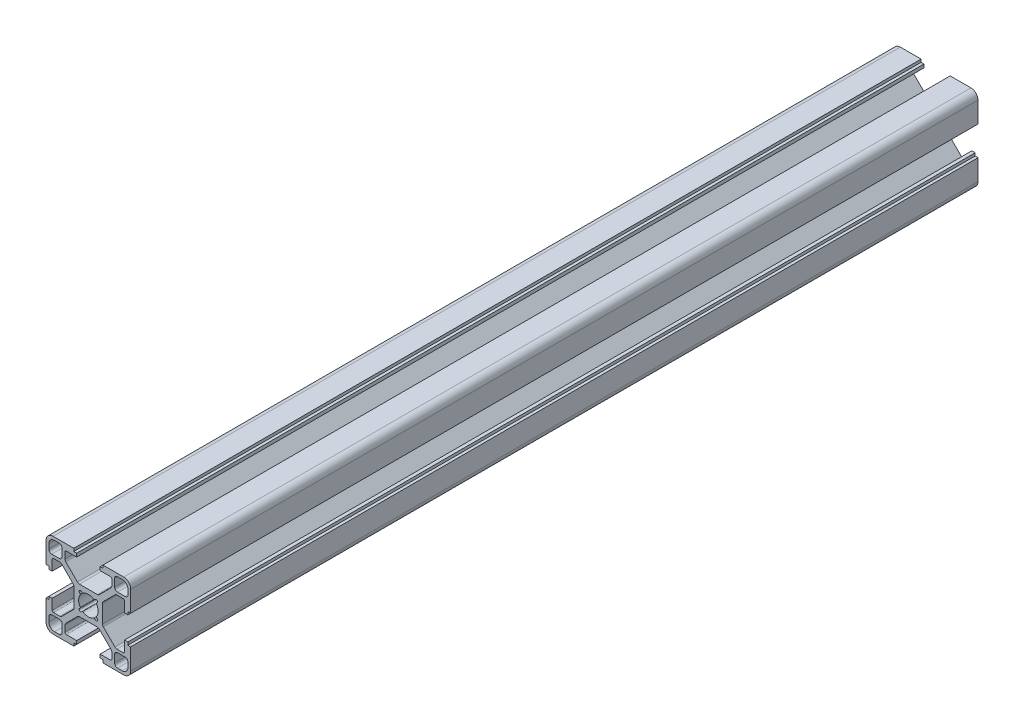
SolidWorks part; units mm, degrees
ref_plane "前视基准面" through (0, 0, 0) normal (0, 0, 1) x (1, 0, 0)
ref_plane "上视基准面" through (0, 0, 0) normal (0, 1, 0) x (1, 0, 0)
ref_plane "右视基准面" through (0, 0, 0) normal (1, 0, 0) x (0, 0, -1)
sketch "草图1" plane through (0, 0, 0) normal (0, 0, 1) x (1, 0, 0)
  line B0 (-9.3, 10.3) -> (-9.3, 13)
  line B1 (-10.3, 14) -> (-12, 14)
  line B2 (-14, 12) -> (-14, 10.3)
  line B3 (-13, 9.3) -> (-10.3, 9.3)
  line B4 (3.1201, -2.4148) -> (2.9148, -2.2095)
  line B5 (2.9148, 2.2095) -> (3.1201, 2.4148)
  line B6 (2.4148, 3.1201) -> (2.2095, 2.9148)
  line B7 (-2.2095, 2.9148) -> (-2.4148, 3.1201)
  line B8 (-3.1201, 2.4148) -> (-2.9148, 2.2095)
  line B9 (-2.9148, -2.2095) -> (-3.1201, -2.4148)
  line B10 (-2.4148, -3.1201) -> (-2.2095, -2.9148)
  line B11 (2.2095, -2.9148) -> (2.4148, -3.1201)
  line B12 (10.3, 9.3) -> (13, 9.3)
  line B13 (14, 10.3) -> (14, 12)
  line B14 (12, 14) -> (10.3, 14)
  line B15 (9.3, 13) -> (9.3, 10.3)
  line B16 (12.5, 15) -> (5.15, 15)
  line B17 (5.15, 15) -> (5.15, 14)
  line B18 (5.15, 14) -> (4.15, 14)
  line B19 (4.15, 14) -> (4.15, 12.8)
  line B20 (4.15, 12.8) -> (7.8, 12.8)
  line B21 (8.3, 12.3) -> (8.3, 10.1284)
  line B22 (8.0071, 9.4213) -> (3.8787, 5.2929)
  line B23 (3.1716, 5) -> (0, 5)
  line B24 (0, 5) -> (-3.1716, 5)
  line B25 (-3.8787, 5.2929) -> (-8.0071, 9.4213)
  line B26 (-8.3, 10.1284) -> (-8.3, 12.3)
  line B27 (-7.8, 12.8) -> (-4.15, 12.8)
  line B28 (-4.15, 12.8) -> (-4.15, 14)
  line B29 (-4.15, 14) -> (-5.15, 14)
  line B30 (-5.15, 14) -> (-5.15, 15)
  line B31 (-5.15, 15) -> (-12.5, 15)
  line B32 (-15, 12.5) -> (-15, 5.15)
  line B33 (-15, 5.15) -> (-14, 5.15)
  line B34 (-14, 5.15) -> (-14, 4.15)
  line B35 (-14, 4.15) -> (-12.8, 4.15)
  line B36 (-12.8, 4.15) -> (-12.8, 7.8)
  line B37 (-12.3, 8.3) -> (-10.1284, 8.3)
  line B38 (-9.4213, 8.0071) -> (-5.2929, 3.8787)
  line B39 (-5, 3.1716) -> (-5, 0)
  line B40 (-5, 0) -> (-5, -3.1716)
  line B41 (-5.2929, -3.8787) -> (-9.4213, -8.0071)
  line B42 (-10.1284, -8.3) -> (-12.3, -8.3)
  line B43 (-12.8, -7.8) -> (-12.8, -4.15)
  line B44 (-12.8, -4.15) -> (-14, -4.15)
  line B45 (-14, -4.15) -> (-14, -5.15)
  line B46 (-14, -5.15) -> (-15, -5.15)
  line B47 (-15, -5.15) -> (-15, -12.5)
  line B48 (-12.5, -15) -> (-5.15, -15)
  line B49 (-5.15, -15) -> (-5.15, -14)
  line B50 (-5.15, -14) -> (-4.15, -14)
  line B51 (-4.15, -14) -> (-4.15, -12.8)
  line B52 (-4.15, -12.8) -> (-7.8, -12.8)
  line B53 (-8.3, -12.3) -> (-8.3, -10.1284)
  line B54 (-8.0071, -9.4213) -> (-3.8787, -5.2929)
  line B55 (-3.1716, -5) -> (0, -5)
  line B56 (0, -5) -> (3.1716, -5)
  line B57 (3.8787, -5.2929) -> (8.0071, -9.4213)
  line B58 (8.3, -10.1284) -> (8.3, -12.3)
  line B59 (7.8, -12.8) -> (4.15, -12.8)
  line B60 (4.15, -12.8) -> (4.15, -14)
  line B61 (4.15, -14) -> (5.15, -14)
  line B62 (5.15, -14) -> (5.15, -15)
  line B63 (5.15, -15) -> (12.5, -15)
  line B64 (15, -12.5) -> (15, -5.15)
  line B65 (15, -5.15) -> (14, -5.15)
  line B66 (14, -5.15) -> (14, -4.15)
  line B67 (14, -4.15) -> (12.8, -4.15)
  line B68 (12.8, -4.15) -> (12.8, -7.8)
  line B69 (12.3, -8.3) -> (10.1284, -8.3)
  line B70 (9.4213, -8.0071) -> (5.2929, -3.8787)
  line B71 (5, -3.1716) -> (5, 0)
  line B72 (5, 0) -> (5, 3.1716)
  line B73 (5.2929, 3.8787) -> (9.4213, 8.0071)
  line B74 (10.1284, 8.3) -> (12.3, 8.3)
  line B75 (12.8, 7.8) -> (12.8, 4.15)
  line B76 (12.8, 4.15) -> (14, 4.15)
  line B77 (14, 4.15) -> (14, 5.15)
  line B78 (14, 5.15) -> (15, 5.15)
  line B79 (15, 5.15) -> (15, 12.5)
  line B80 (-10.3, -9.3) -> (-13, -9.3)
  line B81 (-14, -10.3) -> (-14, -12)
  line B82 (-12, -14) -> (-10.3, -14)
  line B83 (-9.3, -13) -> (-9.3, -10.3)
  line B84 (9.3, -10.3) -> (9.3, -13)
  line B85 (10.3, -14) -> (12, -14)
  line B86 (14, -12) -> (14, -10.3)
  line B87 (13, -9.3) -> (10.3, -9.3)
  arc B88 (-9.5929, 9.5929) -> (-9.3, 10.3) centre (-10.3, 10.3) ccw
  arc B89 (-9.3, 13) -> (-10.3, 14) centre (-10.3, 13) ccw
  arc B90 (-12, 14) -> (-14, 12) centre (-12, 12) ccw
  arc B91 (-14, 10.3) -> (-13, 9.3) centre (-13, 10.3) ccw
  arc B92 (-10.3, 9.3) -> (-9.5929, 9.5929) centre (-10.3, 10.3) ccw
  arc B93 (2.8827, -1.8954) -> (2.9148, -2.2095) centre (3.0916, -2.0328) ccw
  arc B94 (2.8827, -1.8954) -> (3.45, 0) centre (0, 0) ccw
  arc B95 (3.45, 0) -> (2.8827, 1.8954) centre (0, 0) ccw
  arc B96 (2.9148, 2.2095) -> (2.8827, 1.8954) centre (3.0916, 2.0328) ccw
  arc B97 (3.1201, 2.4148) -> (2.4148, 3.1201) centre (2.7675, 2.7675) ccw
  arc B98 (1.8954, 2.8827) -> (2.2095, 2.9148) centre (2.0328, 3.0916) ccw
  arc B99 (1.8954, 2.8827) -> (0, 3.45) centre (0, 0) ccw
  arc B100 (0, 3.45) -> (-1.8954, 2.8827) centre (0, 0) ccw
  arc B101 (-2.2095, 2.9148) -> (-1.8954, 2.8827) centre (-2.0328, 3.0916) ccw
  arc B102 (-2.4148, 3.1201) -> (-3.1201, 2.4148) centre (-2.7675, 2.7675) ccw
  arc B103 (-2.8827, 1.8954) -> (-2.9148, 2.2095) centre (-3.0916, 2.0328) ccw
  arc B104 (-2.8827, 1.8954) -> (-3.45, 0) centre (0, 0) ccw
  arc B105 (-3.45, 0) -> (-2.8827, -1.8954) centre (0, 0) ccw
  arc B106 (-2.9148, -2.2095) -> (-2.8827, -1.8954) centre (-3.0916, -2.0328) ccw
  arc B107 (-3.1201, -2.4148) -> (-2.4148, -3.1201) centre (-2.7675, -2.7675) ccw
  arc B108 (-1.8954, -2.8827) -> (-2.2095, -2.9148) centre (-2.0328, -3.0916) ccw
  arc B109 (-1.8954, -2.8827) -> (0, -3.45) centre (0, 0) ccw
  arc B110 (0, -3.45) -> (1.8954, -2.8827) centre (0, 0) ccw
  arc B111 (2.2095, -2.9148) -> (1.8954, -2.8827) centre (2.0328, -3.0916) ccw
  arc B112 (2.4148, -3.1201) -> (3.1201, -2.4148) centre (2.7675, -2.7675) ccw
  arc B113 (9.3, 10.3) -> (9.5929, 9.5929) centre (10.3, 10.3) ccw
  arc B114 (9.5929, 9.5929) -> (10.3, 9.3) centre (10.3, 10.3) ccw
  arc B115 (13, 9.3) -> (14, 10.3) centre (13, 10.3) ccw
  arc B116 (14, 12) -> (12, 14) centre (12, 12) ccw
  arc B117 (10.3, 14) -> (9.3, 13) centre (10.3, 13) ccw
  arc B118 (14.2678, 14.2678) -> (12.5, 15) centre (12.5, 12.5) ccw
  arc B119 (8.3, 12.3) -> (7.8, 12.8) centre (7.8, 12.3) ccw
  arc B120 (8.0071, 9.4213) -> (8.3, 10.1284) centre (7.3, 10.1284) ccw
  arc B121 (3.1716, 5) -> (3.8787, 5.2929) centre (3.1716, 6) ccw
  arc B122 (-3.8787, 5.2929) -> (-3.1716, 5) centre (-3.1716, 6) ccw
  arc B123 (-8.3, 10.1284) -> (-8.0071, 9.4213) centre (-7.3, 10.1284) ccw
  arc B124 (-7.8, 12.8) -> (-8.3, 12.3) centre (-7.8, 12.3) ccw
  arc B125 (-12.5, 15) -> (-14.2678, 14.2678) centre (-12.5, 12.5) ccw
  arc B126 (-14.2678, 14.2678) -> (-15, 12.5) centre (-12.5, 12.5) ccw
  arc B127 (-12.3, 8.3) -> (-12.8, 7.8) centre (-12.3, 7.8) ccw
  arc B128 (-9.4213, 8.0071) -> (-10.1284, 8.3) centre (-10.1284, 7.3) ccw
  arc B129 (-5, 3.1716) -> (-5.2929, 3.8787) centre (-6, 3.1716) ccw
  arc B130 (-5.2929, -3.8787) -> (-5, -3.1716) centre (-6, -3.1716) ccw
  arc B131 (-10.1284, -8.3) -> (-9.4213, -8.0071) centre (-10.1284, -7.3) ccw
  arc B132 (-12.8, -7.8) -> (-12.3, -8.3) centre (-12.3, -7.8) ccw
  arc B133 (-15, -12.5) -> (-14.2678, -14.2678) centre (-12.5, -12.5) ccw
  arc B134 (-14.2678, -14.2678) -> (-12.5, -15) centre (-12.5, -12.5) ccw
  arc B135 (-8.3, -12.3) -> (-7.8, -12.8) centre (-7.8, -12.3) ccw
  arc B136 (-8.0071, -9.4213) -> (-8.3, -10.1284) centre (-7.3, -10.1284) ccw
  arc B137 (-3.1716, -5) -> (-3.8787, -5.2929) centre (-3.1716, -6) ccw
  arc B138 (3.8787, -5.2929) -> (3.1716, -5) centre (3.1716, -6) ccw
  arc B139 (8.3, -10.1284) -> (8.0071, -9.4213) centre (7.3, -10.1284) ccw
  arc B140 (7.8, -12.8) -> (8.3, -12.3) centre (7.8, -12.3) ccw
  arc B141 (12.5, -15) -> (14.2678, -14.2678) centre (12.5, -12.5) ccw
  arc B142 (14.2678, -14.2678) -> (15, -12.5) centre (12.5, -12.5) ccw
  arc B143 (12.3, -8.3) -> (12.8, -7.8) centre (12.3, -7.8) ccw
  arc B144 (9.4213, -8.0071) -> (10.1284, -8.3) centre (10.1284, -7.3) ccw
  arc B145 (5, -3.1716) -> (5.2929, -3.8787) centre (6, -3.1716) ccw
  arc B146 (5.2929, 3.8787) -> (5, 3.1716) centre (6, 3.1716) ccw
  arc B147 (10.1284, 8.3) -> (9.4213, 8.0071) centre (10.1284, 7.3) ccw
  arc B148 (12.8, 7.8) -> (12.3, 8.3) centre (12.3, 7.8) ccw
  arc B149 (15, 12.5) -> (14.2678, 14.2678) centre (12.5, 12.5) ccw
  arc B150 (-9.3, -10.3) -> (-9.5929, -9.5929) centre (-10.3, -10.3) ccw
  arc B151 (-9.5929, -9.5929) -> (-10.3, -9.3) centre (-10.3, -10.3) ccw
  arc B152 (-13, -9.3) -> (-14, -10.3) centre (-13, -10.3) ccw
  arc B153 (-14, -12) -> (-12, -14) centre (-12, -12) ccw
  arc B154 (-10.3, -14) -> (-9.3, -13) centre (-10.3, -13) ccw
  arc B155 (9.5929, -9.5929) -> (9.3, -10.3) centre (10.3, -10.3) ccw
  arc B156 (9.3, -13) -> (10.3, -14) centre (10.3, -13) ccw
  arc B157 (12, -14) -> (14, -12) centre (12, -12) ccw
  arc B158 (14, -10.3) -> (13, -9.3) centre (13, -10.3) ccw
  arc B159 (10.3, -9.3) -> (9.5929, -9.5929) centre (10.3, -10.3) ccw
sketch_block_instance "A$C6BF8383F-1"
sketch_block "A$C6BF8383F"
extrude "凸台-拉伸1" add sketch "草图1" along normal mid plane 300
